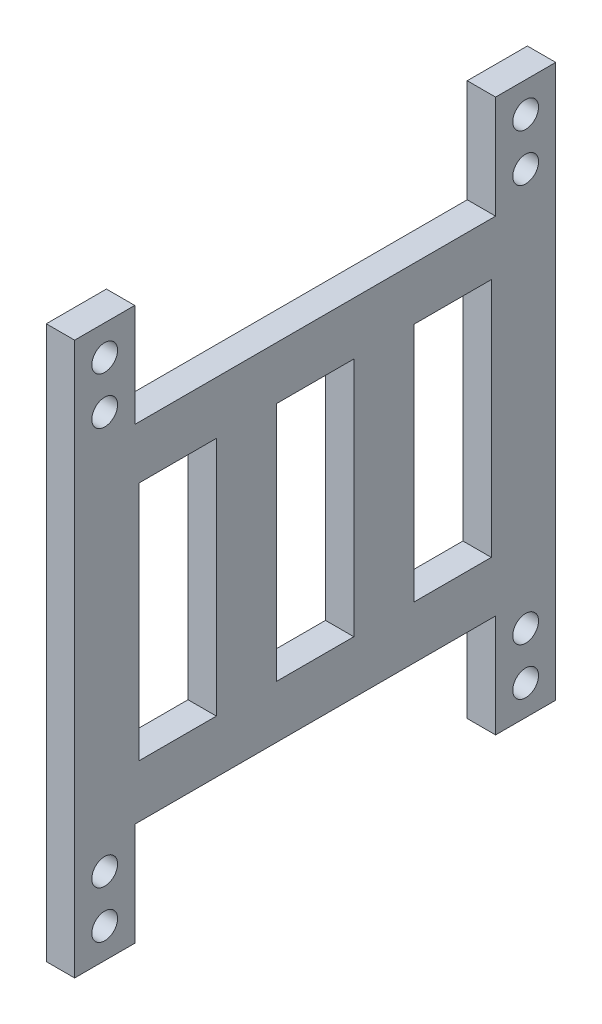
SolidWorks part; units mm, degrees
ref_plane "Front Plane" through (0, 0, 0) normal (0, 0, 1) x (1, 0, 0)
ref_plane "Top Plane" through (0, 0, 0) normal (0, 1, 0) x (1, 0, 0)
ref_plane "Right Plane" through (0, 0, 0) normal (1, 0, 0) x (0, 0, -1)
sketch "Sketch2" plane through (0, 0, 0) normal (1, 0, 0) x (0, 0, -1)
  line L0 (-28, 0) -> (31.8543, 0)
  line L1 (-28, -20.15) -> (28, -20.15)
  line L2 (-28, -20.15) -> (-28, 20.15)
  line L3 (-28, 20.15) -> (28, 20.15)
  line L4 (28, -20.15) -> (28, 20.15)
  line L5 (-28, -20.15) -> (28, 20.15) construction
  line L6 (-28, 20.15) -> (28, -20.15) construction
  line L7 (-28, 20.15) -> (-21, 20.15)
  line L8 (-28, 20.15) -> (-28, 32.15)
  line L9 (-28, 32.15) -> (-21, 32.15)
  line L10 (-21, 20.15) -> (-21, 32.15)
  line L11 (28, 20.15) -> (21, 20.15)
  line L12 (28, 20.15) -> (28, 32.15)
  line L13 (28, 32.15) -> (21, 32.15)
  line L14 (21, 20.15) -> (21, 32.15)
  line L15 (28, -20.15) -> (21, -20.15)
  line L16 (28, -20.15) -> (28, -32.15)
  line L17 (28, -32.15) -> (21, -32.15)
  line L18 (21, -20.15) -> (21, -32.15)
  line L19 (-28, -20.15) -> (-21, -20.15)
  line L20 (-28, -20.15) -> (-28, -32.15)
  line L21 (-28, -32.15) -> (-21, -32.15)
  line L22 (-21, -20.15) -> (-21, -32.15)
  line L23 (0, 32.8931) -> (0, -31.5654)
  circle A8 centre (-24.5, 28.65) radius 1.5
  circle A9 centre (-24.5, 23.15) radius 1.5
  circle A10 centre (24.5, 23.15) radius 1.5
  circle A11 centre (24.5, 28.65) radius 1.5
  circle A12 centre (24.5, -23.15) radius 1.5
  circle A13 centre (24.5, -28.65) radius 1.5
  circle A14 centre (-24.5, -23.15) radius 1.5
  circle A15 centre (-24.5, -28.65) radius 1.5
  point P0 (0, 0)
  dimension "D13" = 5.5
  dimension "D11" = 3
  dimension "D1" = 40.3
  dimension "D2" = 56
  dimension "D3" = 12
  dimension "D4" = 12
  dimension "D5" = 12
  dimension "D6" = 12
  dimension "D7" = 7
  dimension "D8" = 7
  dimension "D9" = 7
  dimension "D10" = 7
  dimension "D12" = 3.5
extrude "Boss-Extrude1" add sketch "Sketch2" along normal blind 3.3
sketch "Sketch3" plane through (3.3, 0, 0) normal (1, 0, 0) x (0, 0, -1)
  line L0 (-28, 0) -> (31.8543, 0) construction
  line L1 (-4.5, -14) -> (4.5, -14)
  line L2 (-4.5, -14) -> (-4.5, 14)
  line L3 (-4.5, 14) -> (4.5, 14)
  line L4 (4.5, -14) -> (4.5, 14)
  line L5 (-4.5, -14) -> (4.5, 14) construction
  line L6 (-4.5, 14) -> (4.5, -14) construction
  line L7 (-20.5, -14) -> (-11.5, -14)
  line L8 (-20.5, -14) -> (-20.5, 14)
  line L9 (-20.5, 14) -> (-11.5, 14)
  line L10 (-11.5, -14) -> (-11.5, 14)
  line L11 (-20.5, -14) -> (-11.5, 14) construction
  line L12 (-20.5, 14) -> (-11.5, -14) construction
  line L14 (11.5, -14) -> (20.5, -14)
  line L15 (11.5, -14) -> (11.5, 14)
  line L16 (11.5, 14) -> (20.5, 14)
  line L17 (20.5, -14) -> (20.5, 14)
  line L18 (11.5, -14) -> (20.5, 14) construction
  line L19 (11.5, 14) -> (20.5, -14) construction
  point P0 (0, 0)
  point P6 (-16, 0)
  point P13 (16, 0)
  dimension "D1" = 9
  dimension "D2" = 28
  dimension "D3" = 7
  dimension "D4" = 7
extrude "Cut-Extrude1" cut sketch "Sketch3" against normal blind 10
